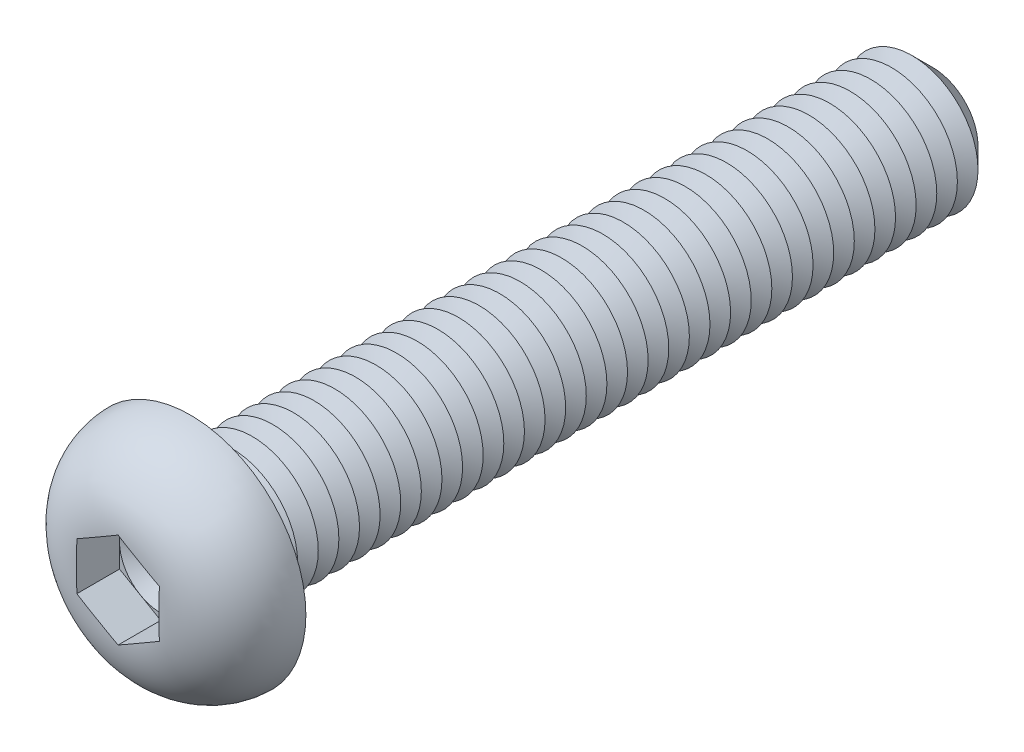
SolidWorks part; units mm, degrees
ref_plane "Front Plane" through (0, 0, 0) normal (0, 0, 1) x (1, 0, 0)
ref_plane "Top Plane" through (0, 0, 0) normal (0, 1, 0) x (1, 0, 0)
ref_plane "Right Plane" through (0, 0, 0) normal (1, 0, 0) x (0, 0, -1)
sketch "Sketch1" plane through (0, 0, 0) normal (1, 0, 0) x (0, 0, -1)
  line L0 (-47.9342, 0) -> (60.3146, 0) construction
sketch "Sketch2" plane through (0, 0, 0) normal (1, 0, 0) x (0, 0, -1)
  line L0 (0, 0) -> (-4.4, 0)
  line L1 (-47.9342, 0) -> (60.3146, 0) construction
  line L2 (-4.4, 0) -> (-4.4, 2.5011)
  line L3 (0, 7) -> (0, 0)
  arc A0 (-4.4, 2.5011) -> (0, 7) centre (0.1, 2.5011) cw
  dimension "D1" = 4.5
  dimension "D2" = 4.4
  dimension "D3" = 7
revolve "Revolve1" add sketch "Sketch2" angle 360 about L0
sketch "Sketch3" plane through (0, 0, 4.4) normal (0, 0, 1) x (1, 0, 0)
  line L1 (0, 2.8868) -> (-2.5, 1.4434)
  line L2 (-2.5, 1.4434) -> (-2.5, -1.4434)
  line L3 (-2.5, -1.4434) -> (0, -2.8868)
  line L4 (0, -2.8868) -> (2.5, -1.4434)
  line L5 (2.5, -1.4434) -> (2.5, 1.4434)
  line L6 (2.5, 1.4434) -> (0, 2.8868)
  circle A0 centre (0, 0) radius 2.5 construction
  dimension "D1" = 5
extrude "Cut-Extrude1" cut sketch "Sketch3" against normal blind 2.6
sketch "Sketch4" plane through (0, 0, 0) normal (0, 0, -1) x (-1, 0, 0)
  circle A0 centre (0, 0) radius 4
  dimension "D1" = 8
extrude "Boss-Extrude1" add sketch "Sketch4" along normal blind 45
chamfer "Chamfer1" distance 1.25 angle 45 1 edges at (-4, 0, -45)
sketch "Sketch5" plane through (0, 0, 0) normal (1, 0, 0) x (0, 0, -1)
  line L0 (1.25, 4) -> (2.5, 4)
  line L1 (43.75, 4) -> (0, 4) construction
  line L2 (2.5, 4) -> (1.875, 2.9175)
  line L3 (1.875, 2.9175) -> (1.25, 4)
  line L4 (0, -7) -> (0, 7) construction
  line L5 (43.75, 4) -> (0, 4) construction
  dimension "D1" = 1.25
  dimension "D2" = 1.25
revolve "Cut-Revolve1" cut sketch "Sketch5" angle 360 about L0
pattern_linear "LPattern1" count 34 spacing 1.25 along (0, 0, -1) of "Cut-Revolve1"
fillet "Fillet2" radius 0.5 1 edges at (4, 0, 0)
sketch "Sketch6" plane through (0, 0, 1.8) normal (0, 0, 1) x (1, 0, 0)
  line L0 (0, -2.8868) -> (2.5, -1.4434) construction
  circle A0 centre (0, 0) radius 2.5
extrude "Cut-Extrude2" cut sketch "Sketch6" against normal through all draft 60
